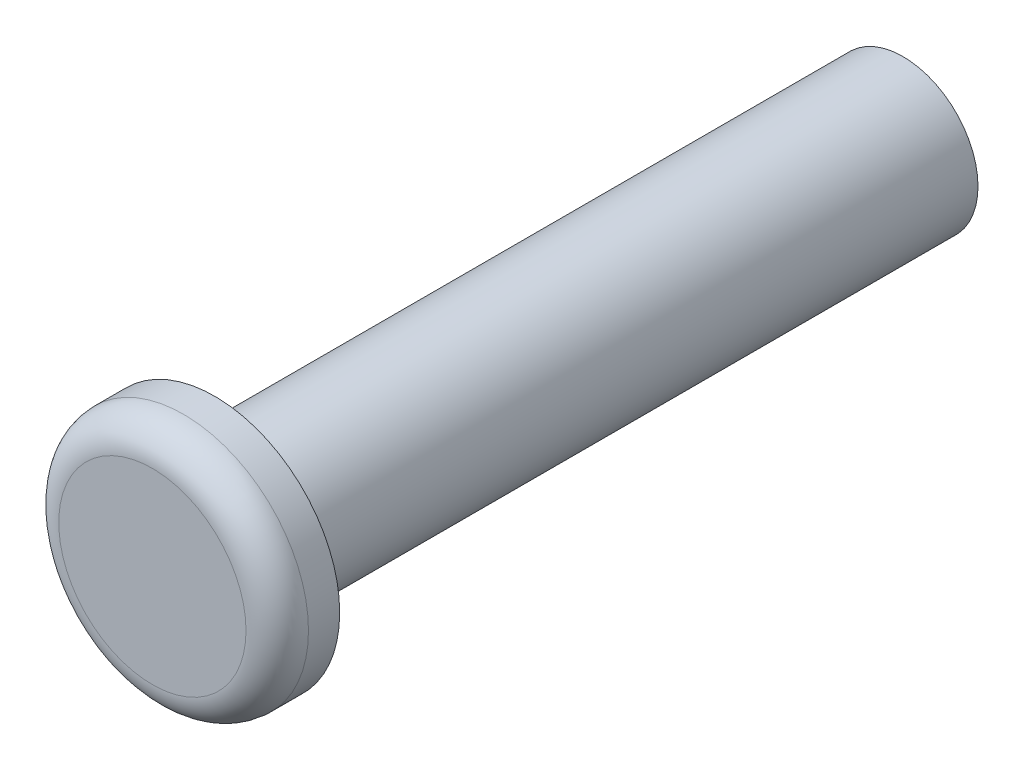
SolidWorks part; units mm, degrees
ref_plane "Front" through (0, 0, 0) normal (0, 0, 1) x (1, 0, 0)
ref_plane "Top" through (0, 0, 0) normal (0, 1, 0) x (1, 0, 0)
ref_plane "Right" through (0, 0, 0) normal (1, 0, 0) x (0, 0, -1)
sketch "Sketch1" plane through (0, 0, 0) normal (0, 0, 1) x (1, 0, 0)
  circle A0 centre (0, 0) radius 3.81
  dimension "D1" = 7.62
extrude "Base-Extrude" add sketch "Sketch1" against normal blind 35
sketch "Sketch2" plane through (0, 0, 0) normal (0, 0, 1) x (1, 0, 0)
  circle A0 centre (0, 0) radius 6.35
  dimension "D1" = 12.7
extrude "Boss-Extrude1" add sketch "Sketch2" along normal blind 3.175
fillet "Fillet1" radius 1.5875 1 edges at (6.35, 0, 3.175)
